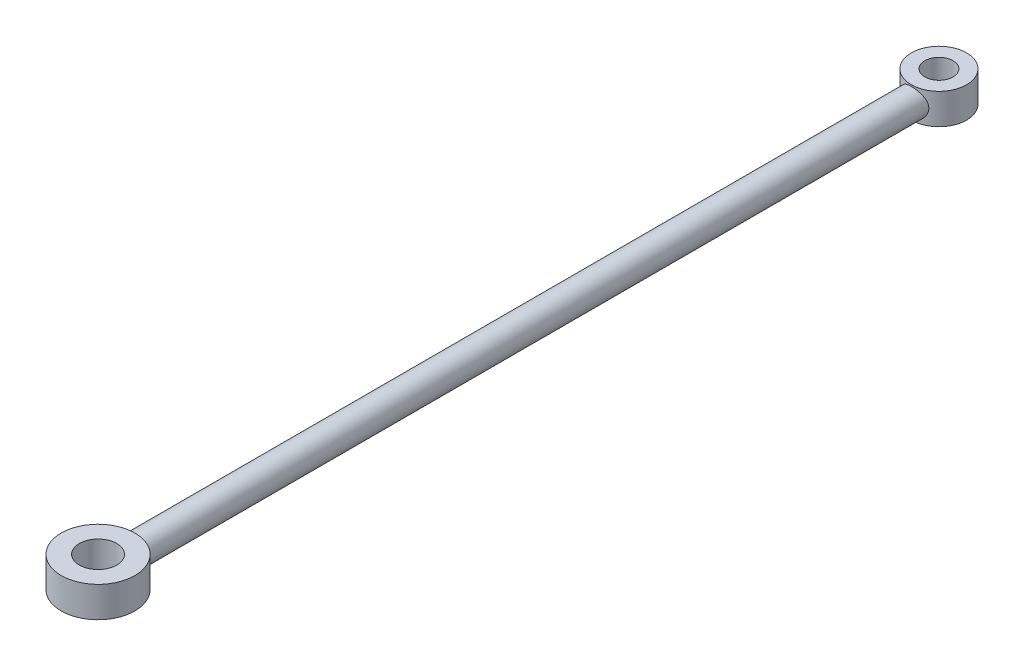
SolidWorks part; units mm, degrees
ref_plane "Front Plane" through (0, 0, 0) normal (0, 0, 1) x (1, 0, 0)
ref_plane "Top Plane" through (0, 0, 0) normal (0, 1, 0) x (1, 0, 0)
ref_plane "Right Plane" through (0, 0, 0) normal (1, 0, 0) x (0, 0, -1)
sketch "Sketch2" plane through (0, 0, 0) normal (0, 1, 0) x (1, 0, 0)
  circle A0 centre (0, 0) radius 6
  dimension "D1" = 12
extrude "Boss-Extrude1" add sketch "Sketch2" along normal blind 5
sketch "Sketch3" plane through (0, 5, 0) normal (0, 1, 0) x (1, 0, 0)
  circle A0 centre (0, 0) radius 3.05
  dimension "D1" = 6.1
extrude "Cut-Extrude1" cut sketch "Sketch3" along direction (0, 1, 0) on the side against the normal blind 5 from surface at 0
sketch "Sketch4" plane through (0, 0, 0) normal (0, 1, 0) x (1, 0, 0)
  line L0 (0, 0) -> (0, 137) construction
  circle A0 centre (0, 137) radius 4.5
  dimension "D1" = 9
extrude "Boss-Extrude2" add sketch "Sketch4" along normal blind 5 separate body
sketch "Sketch5" plane through (0, 5, 0) normal (0, 1, 0) x (1, 0, 0)
  circle A0 centre (0, 137) radius 2.3
  dimension "D1" = 4.6
extrude "Cut-Extrude2" cut sketch "Sketch5" against normal blind 5
ref_plane "Plane2" through (0, 0, -7) normal (0, 0, 1) x (1, 0, 0)
ref_plane "Plane3" through (0, 0, -24.5) normal (0, 0, -1) x (-1, 0, 0)
sketch "Sketch8" plane through (0, 0, -24.5) normal (0, 0, -1) x (-1, 0, 0)
  circle A3 centre (0, 2.5) radius 2.25
  dimension "D1" = 4.5
extrude "Boss-Extrude3" add sketch "Sketch8" along normal up to next and the other way up to next contours A3
